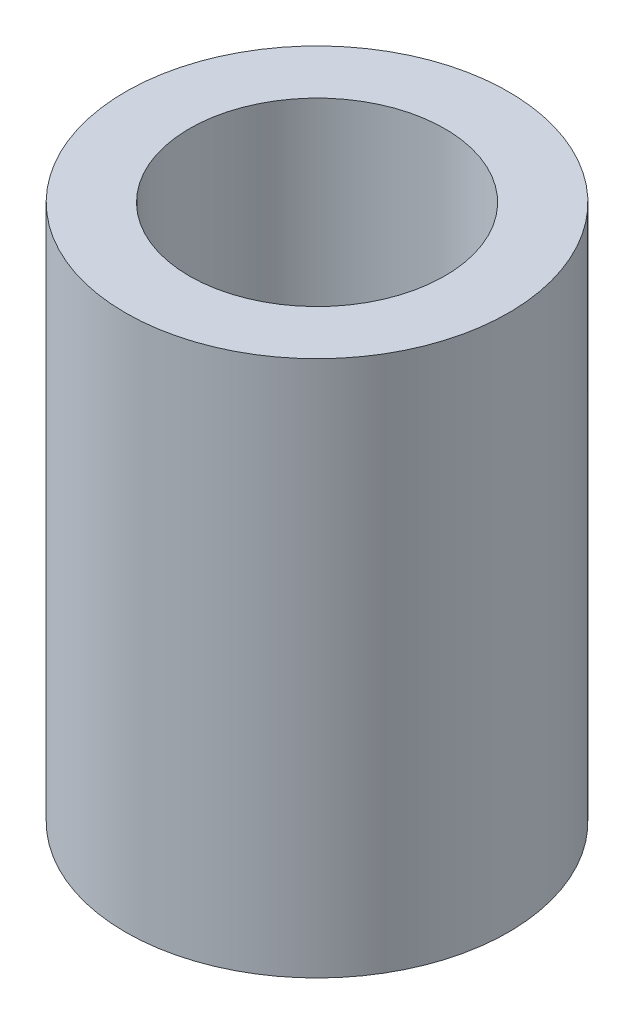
SolidWorks part; units mm, degrees
ref_plane "Спереди" through (0, 0, 0) normal (0, 0, 1) x (1, 0, 0)
ref_plane "Сверху" through (0, 0, 0) normal (0, 1, 0) x (1, 0, 0)
ref_plane "Справа" through (0, 0, 0) normal (1, 0, 0) x (0, 0, -1)
sketch "Эскиз1" plane through (0, 0, 0) normal (0, 1, 0) x (1, 0, 0)
  circle A0 centre (0, 0) radius 1.5
  circle A1 centre (0, 0) radius 1
  dimension "D1" = 3
  dimension "D2" = 0.5
extrude "Бобышка-Вытянуть1" add sketch "Эскиз1" along normal blind 4.2
